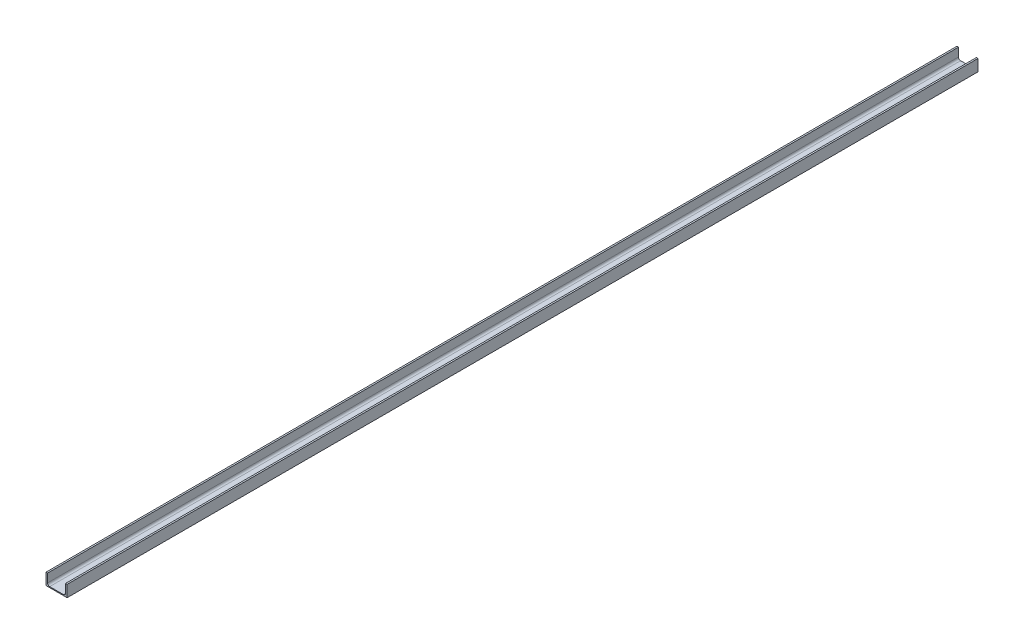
SolidWorks part; units mm, degrees
ref_plane "Plan de face" through (0, 0, 0) normal (0, 0, 1) x (1, 0, 0)
ref_plane "Plan de dessus" through (0, 0, 0) normal (0, 1, 0) x (1, 0, 0)
ref_plane "Plan de droite" through (0, 0, 0) normal (1, 0, 0) x (0, 0, -1)
sketch "Esquisse1" plane through (0, 0, 0) normal (0, 0, 1) x (1, 0, 0)
  line L0 (0, 0) -> (100, 0)
  line L1 (100, 0) -> (100, 55)
  line L2 (100, 55) -> (92.5, 55)
  line L3 (92.5, 55) -> (92.5, 14.5)
  line L4 (82.5, 4.5) -> (17.5, 4.5)
  line L5 (7.5, 14.5) -> (7.5, 55)
  line L6 (0, 0) -> (0, 55)
  line L7 (0, 55) -> (7.5, 55)
  arc A0 (17.5, 4.5) -> (7.5, 14.5) centre (17.5, 14.5) cw
  arc A1 (92.5, 14.5) -> (82.5, 4.5) centre (82.5, 14.5) cw
  dimension "D7" = 10
  dimension "D1" = 100
  dimension "D2" = 55
  dimension "D3" = 7.5
  dimension "D4" = 7.5
  dimension "D5" = 4.5
  dimension "D6" = 55
extrude "Extrusion1" add sketch "Esquisse1" along normal blind 4317 contours L1 L2 L3 A1 L4 A0 L5 L7 L6 L0
sketch "Esquisse2" plane through (0, 4.5, 0) normal (0, 1, 0) x (-1, 0, 0)
  line L1 (0, 4317) -> (0, 0) construction
  line L3 (-82.5, 4317) -> (-17.5, 4317) construction
  circle A0 centre (-50, 4132) radius 7.5
  circle A1 centre (-50, 3823) radius 7.5
  circle A2 centre (-50, 3514) radius 7.5
  circle A3 centre (-50, 3205) radius 7.5
  circle A4 centre (-50, 2896) radius 7.5
  circle A5 centre (-50, 2587) radius 7.5
  circle A6 centre (-50, 2278) radius 7.5
  circle A7 centre (-50, 1969) radius 7.5
  circle A8 centre (-50, 1660) radius 7.5
  circle A9 centre (-50, 1351) radius 7.5
  circle A10 centre (-50, 1042) radius 7.5
  circle A11 centre (-50, 733) radius 7.5
  circle A12 centre (-50, 424) radius 7.5
  circle A13 centre (-50, 115) radius 7.5
  circle A14 centre (-50, 4227) radius 7.5
  dimension "D1" = 15
  dimension "D2" = 15
  dimension "D3" = 50
  dimension "D4" = 50
  dimension "D5" = 95
  dimension "D6" = 90
extrude "Enlèv. mat.-Extru.1" cut sketch "Esquisse2" against normal blind 10
